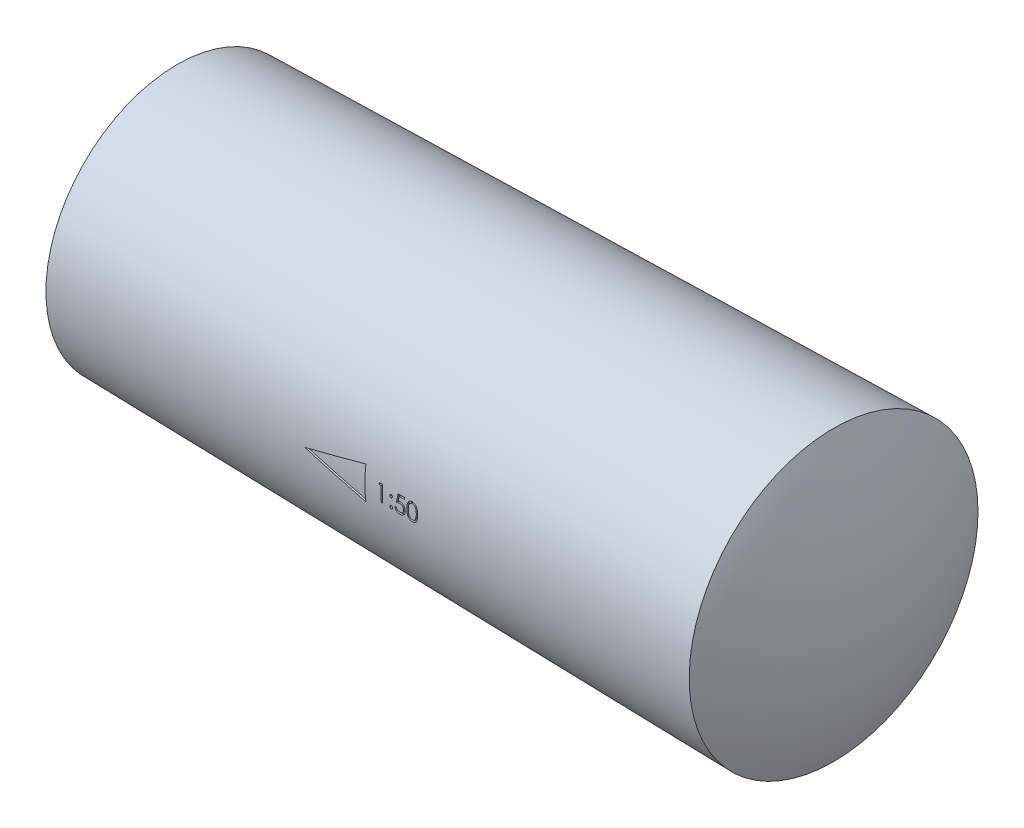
SolidWorks part; units mm, degrees
ref_plane "Front Plane" through (0, 0, 0) normal (0, 0, 1) x (1, 0, 0)
ref_plane "Top Plane" through (0, 0, 0) normal (0, 1, 0) x (1, 0, 0)
ref_plane "Right Plane" through (0, 0, 0) normal (1, 0, 0) x (0, 0, -1)
sketch "Sketch1" plane through (0, 0, 0) normal (1, 0, 0) x (0, 0, -1)
  circle A0 centre (0, 0) radius 8
  dimension "D1" = 16
extrude "Extrude1" add sketch "Sketch1" along normal mid plane 40
draft "Draft1" type of draft neutral plane draft angle 1.146 faces to draft 1 parameters "D1"=1.146
sketch "Sketch2" plane through (0, 0, 0) normal (0, 0, 1) x (1, 0, 0)
  line L0 (-20, 0) -> (-20, 8)
  line L1 (-20, 8) -> (-20, -8) construction
  line L2 (-20, 0) -> (-22, 0)
  line L3 (-22, 0) -> (-22, -8.4) construction
  line L4 (20, 0) -> (20, 8.8)
  line L5 (20, -8.8) -> (20, 8.8) construction
  line L6 (20, 0) -> (22, 0)
  line L7 (22, 0) -> (22, -8.4) construction
  line L8 (-20, -8) -> (20, -8.8) construction
  arc A0 (-22, 0) -> (-20, 8) centre (-5, 0) cw
  arc A1 (22, 0) -> (20, 8.8) centre (1.6399, 0) ccw
  point P14 (0, -8.4)
revolve "Revolve1" add sketch "Sketch2" angle 360 about L2
sketch "Sketch5" plane through (0, 0, 0) normal (0, 0, 1) x (1, 0, 0)
  line L0 (0, 8.4) -> (0, -8.4) construction
  line L1 (20, 8.8) -> (-20, 8) construction
  line L2 (-20, -8) -> (20, -8.8) construction
ref_plane "Plane2" through (0, 0, 0) normal (-0.02, 0, 0.9998) x (0.9998, 0, 0.02)
sketch "Sketch6" plane through (0, 0, 0) normal (-0.02, 0, 0.9998) x (0.9998, 0, 0.02)
  line L0 (0, 0) -> (0, 1)
  line L1 (0, 8.4) -> (0, -8.4) construction
  line L2 (0, 1) -> (-3.7321, 0)
  line L3 (-3.7321, 0) -> (0, -1)
  line L4 (0, -1) -> (0, 0)
  line L5 (0, -0.5) -> (4, -0.5) construction
  text T0 "1:50" font "Century Gothic" height 1
  dimension "D1" = 2
  dimension "D2" = 30
  dimension "D3" = 4
wrap "Wrap2" sketch "Sketch6" wrap type deboss source sketch "Sketch6" thickness 0.1 parameters "D1"=0.1
equation "\"D2@Sketch2\" = \"D1@Sketch2\""
